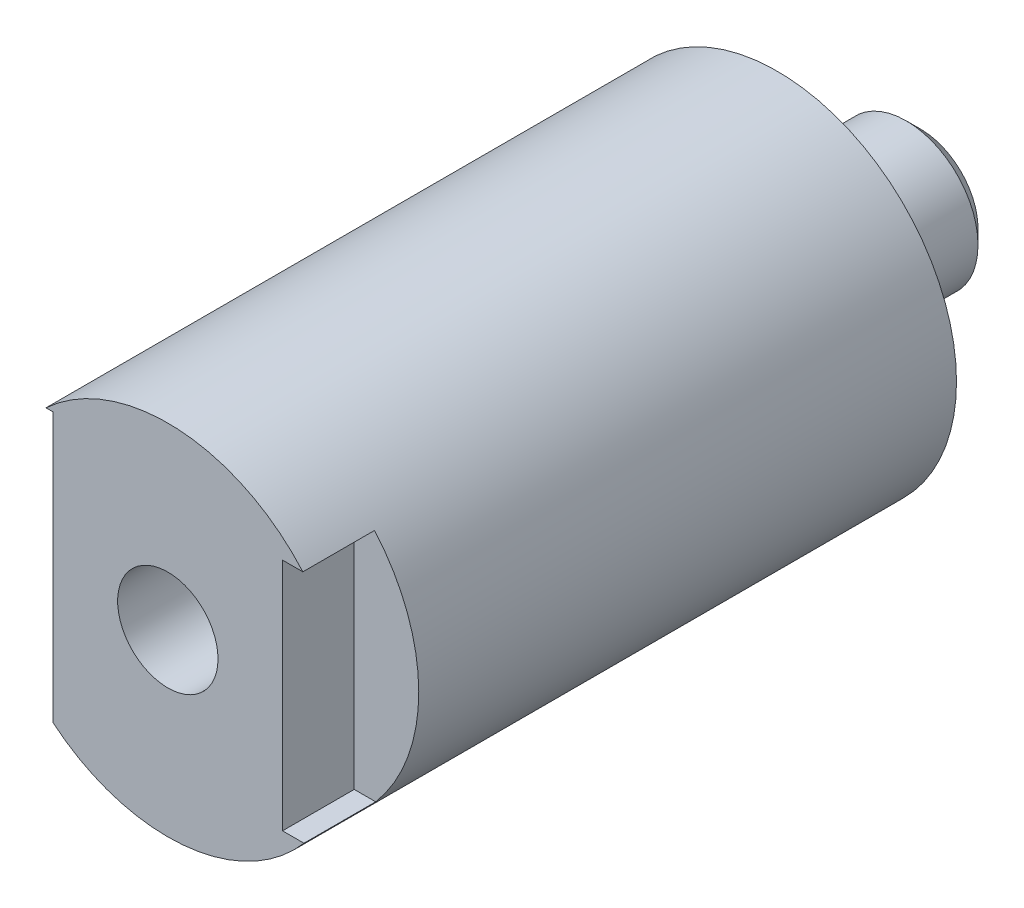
SolidWorks part; units mm, degrees
ref_plane "Face" through (0, 0, 0) normal (0, 0, 1) x (1, 0, 0)
ref_plane "Dessus" through (0, 0, 0) normal (0, 1, 0) x (1, 0, 0)
ref_plane "Droite" through (0, 0, 0) normal (1, 0, 0) x (0, 0, -1)
sketch "Esquisse1" plane through (0, 0, 0) normal (0, 0, 1) x (1, 0, 0)
  circle A0 centre (0, 0) radius 25
  dimension "D1" = 50
extrude "Base-Extrusion" add sketch "Esquisse1" along normal blind 85
sketch "Esquisse3" plane through (0, 0, 85) normal (0, 0, 1) x (1, 0, 0)
  line L1 (16, 16.4408) -> (28.7371, 16.4408)
  line L2 (16, 16.4408) -> (16, -16.2602)
  line L3 (16, -16.2602) -> (28.7371, -16.2602)
  line L4 (28.7371, 16.4408) -> (28.7371, -16.2602)
  line L5 (-28.3758, 18.3379) -> (-16, 18.3379)
  line L6 (-28.3758, 18.3379) -> (-28.3758, -19.2412)
  line L7 (-28.3758, -19.2412) -> (-16, -19.2412)
  line L8 (-16, 18.3379) -> (-16, -19.2412)
  dimension "D1" = 16
  dimension "D2" = 16
extrude "Enlèv. mat.-Extru.2" cut sketch "Esquisse3" against normal blind 10
sketch "Esquisse4" plane through (0, 0, 0) normal (0, 0, -1) x (-1, 0, 0)
  circle A0 centre (0, 0) radius 10
  dimension "D1" = 20
extrude "Boss.-Extru.1" add sketch "Esquisse4" along normal blind 20
chamfer "Chanfrein1" distance 2 angle 45 1 edges at (-10, 0, -20)
hole_wizard "Trou taraudé M16x2.01" positions "Esquisse6" profile "Esquisse5" tap size "M16x2.0" standard "ISO"
sketch "Esquisse6" plane through (0, 0, 85) normal (0, 0, 1) x (1, 0, 0)
  point P0 (0, 0)
sketch "Esquisse5" plane through (0, 0, 85) normal (1, 0, 0) x (0, -1, 0)
  line L0 (0, 0) -> (0, 34.206)
  line L1 (0, 34.206) -> (7, 30)
  line L2 (7, 30) -> (7, 0)
  line L5 (7, 0) -> (0, 0)
  line L10 (0, 34.206) -> (-7, 30) construction
  line L11 (0, -6.35) -> (0, 107.95) construction
  dimension "Diamètre du trou pour taraudage" = 14
  dimension "Profondeur du trou pour taraudage" = 30
  dimension "Angle de pointe" = 118
